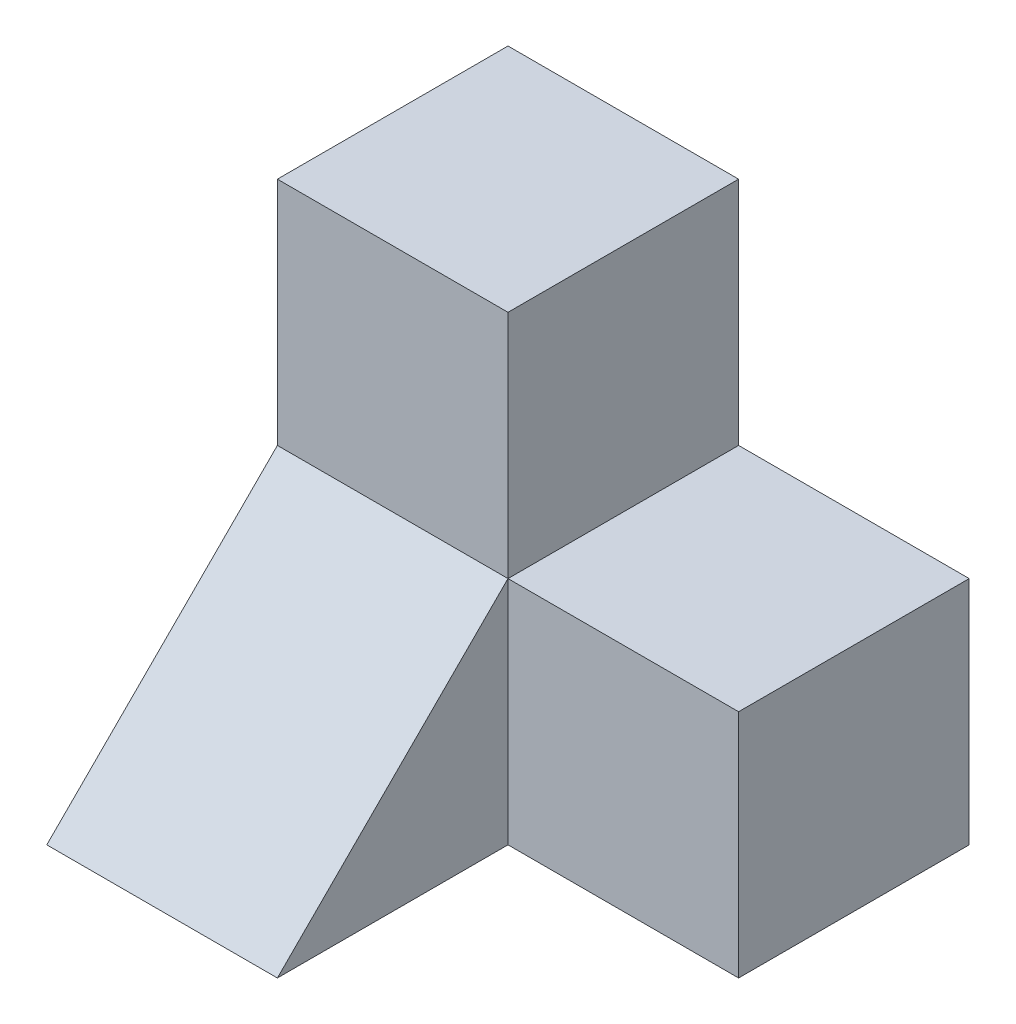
SolidWorks part; units mm, degrees
ref_plane "Plan de face" through (0, 0, 0) normal (0, 0, 1) x (1, 0, 0)
ref_plane "Plan de dessus" through (0, 0, 0) normal (0, 1, 0) x (1, 0, 0)
ref_plane "Plan de droite" through (0, 0, 0) normal (1, 0, 0) x (0, 0, -1)
sketch "Esquisse1" plane through (0, 0, 0) normal (0, 0, 1) x (1, 0, 0)
  line L0 (20, 0) -> (20, 10)
  line L1 (0, 20) -> (10, 20)
  line L2 (0, 20) -> (0, 0)
  line L3 (0, 0) -> (20, 0)
  line L4 (20, 10) -> (10, 10)
  line L5 (10, 10) -> (10, 20)
  dimension "D1" = 10
  dimension "D2" = 10
  dimension "D3" = 20
  dimension "D4" = 20
extrude "Boss.-Extru.1" add sketch "Esquisse1" along normal blind 10
sketch "Esquisse2" plane through (0, 0, 10) normal (0, 0, 1) x (1, 0, 0)
  line L1 (0, 0) -> (10, 0)
  line L2 (0, 0) -> (0, 10)
  line L3 (0, 10) -> (10, 10)
  line L4 (10, 0) -> (10, 10)
extrude "Boss.-Extru.2" add sketch "Esquisse2" along normal blind 10
chamfer "Chanfrein1" distance 10 angle 45 1 edges at (5, 10, 20)
